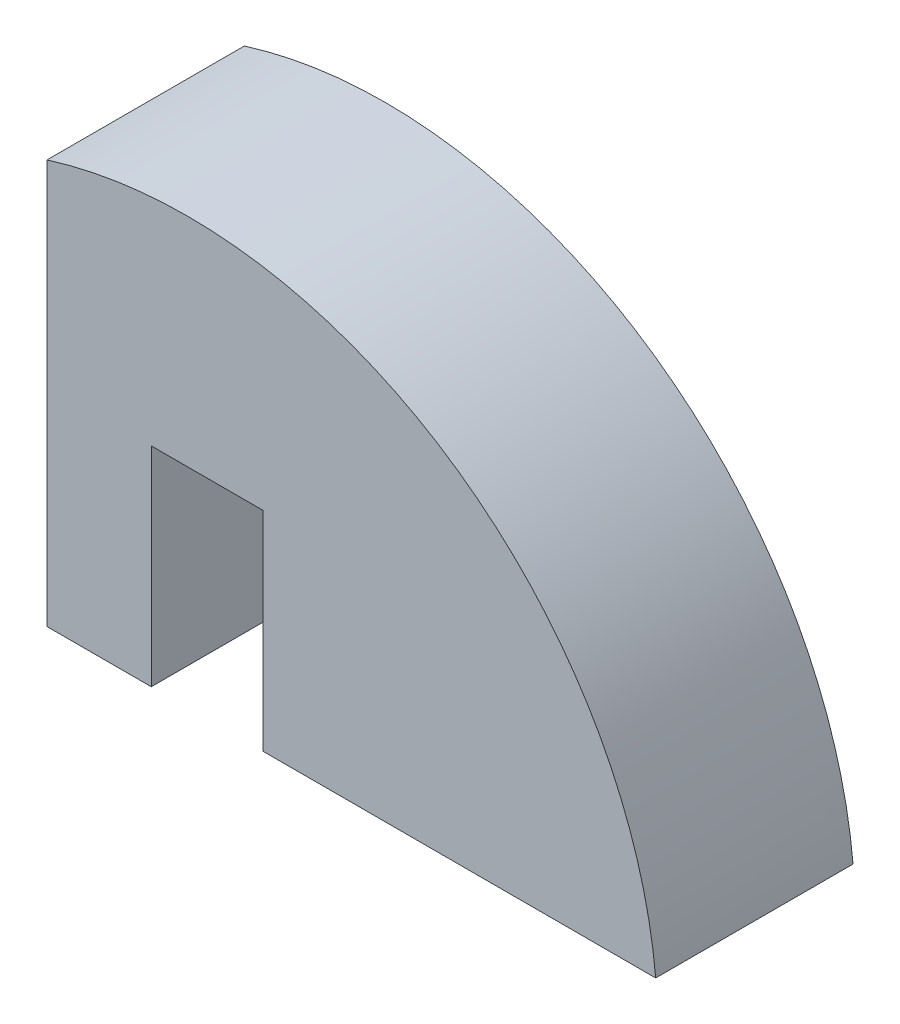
SolidWorks part; units mm, degrees
ref_plane "Plan de face" through (0, 0, 0) normal (0, 0, 1) x (1, 0, 0)
ref_plane "Plan de dessus" through (0, 0, 0) normal (0, 1, 0) x (1, 0, 0)
ref_plane "Plan de droite" through (0, 0, 0) normal (1, 0, 0) x (0, 0, -1)
sketch "Esquisse1" plane through (0, 0, 0) normal (0, 0, 1) x (1, 0, 0)
  line L0 (-150, 46.9696) -> (-150, 476.9696)
  line L1 (-150, 46.9696) -> (-39, 46.9696)
  line L2 (80, 46.9696) -> (497.789, 46.9696)
  line L4 (-39, 46.9696) -> (-39, 268.9696)
  line L5 (-39, 268.9696) -> (80, 268.9696)
  line L6 (80, 46.9696) -> (80, 268.9696)
  arc A0 (497.789, 46.9696) -> (-150, 476.9696) centre (0, 0) ccw
  dimension "D1" = 1000
  dimension "D2" = 430
  dimension "D3" = 647.789
  dimension "D4" = 111
  dimension "D5" = 119
  dimension "D6" = 222
extrude "Extrusion1" add sketch "Esquisse1" along normal blind 210
sketch "Esquisse2" plane through (0, 0, 0) normal (0, 0, -1) x (-1, 0, 0)
  line L0 (140, 469.5743) -> (140, 56.9696)
  line L1 (140, 56.9696) -> (49, 56.9696)
  line L2 (49, 56.9696) -> (49, 278.9696)
  line L3 (49, 278.9696) -> (-90, 278.9696)
  line L4 (-90, 278.9696) -> (-90, 56.9696)
  line L5 (-90, 56.9696) -> (-486.677, 56.9696)
  line L6 (150, 476.9696) -> (150, 46.9696) construction
  line L7 (150, 46.9696) -> (39, 46.9696) construction
  line L8 (39, 46.9696) -> (39, 268.9696) construction
  line L9 (39, 268.9696) -> (-80, 268.9696) construction
  line L10 (-80, 268.9696) -> (-80, 46.9696) construction
  line L11 (-80, 46.9696) -> (-497.789, 46.9696) construction
  arc A0 (140, 469.5743) -> (-486.677, 56.9696) centre (0, 0) ccw
  dimension "D1" = 980
  dimension "D2" = 10
  dimension "D3" = 10
  dimension "D4" = 10
  dimension "D5" = 10
  dimension "D6" = 10
  dimension "D7" = 10
extrude "Enlèv. mat.-Extru.1" cut sketch "Esquisse2" against normal blind 20
sketch "Esquisse4" plane through (0, 0, 0) normal (0, 0, -1) x (-1, 0, 0)
  line L0 (-80, 46.9696) -> (-497.789, 46.9696) construction
  line L1 (-486.677, 56.9696) -> (-90, 56.9696)
  line L2 (-486.677, 56.9696) -> (-486.677, 46.9696)
  line L3 (-486.677, 46.9696) -> (-90, 46.9696)
  line L4 (-90, 56.9696) -> (-90, 46.9696)
  line L5 (-80, 268.9696) -> (-80, 46.9696) construction
  line L6 (150, 476.9696) -> (150, 46.9696) construction
  line L7 (140, 469.5743) -> (150, 469.5743)
  line L8 (140, 469.5743) -> (140, 56.9696)
  line L9 (140, 56.9696) -> (150, 56.9696)
  line L10 (150, 469.5743) -> (150, 56.9696)
  line L11 (150, 46.9696) -> (39, 46.9696) construction
  dimension "D1" = 10
  dimension "D2" = 10
extrude "Enlèv. mat.-Extru.2" cut sketch "Esquisse4" against normal blind 20
sketch "Esquisse5" plane through (0, 46.9696, 0) normal (0, -1, 0) x (1, 0, 0)
  line L0 (80, 210) -> (497.789, 210) construction
  line L1 (109.12, 159.29) -> (244.49, 159.29)
  line L2 (109.12, 159.29) -> (109.12, 114.29)
  line L3 (109.12, 63.77) -> (244.49, 63.77)
  line L4 (244.49, 159.29) -> (244.49, 114.29)
  line L5 (80, 210) -> (80, 0) construction
  line L6 (109.12, 114.29) -> (244.49, 114.29)
  line L7 (244.49, 108.77) -> (109.12, 108.77)
  line L8 (244.49, 108.77) -> (244.49, 63.77)
  line L9 (109.12, 108.77) -> (109.12, 63.77)
  dimension "D1" = 95.52
  dimension "D2" = 50.71
  dimension "D3" = 135.37
  dimension "D4" = 29.12
  dimension "D5" = 45
  dimension "D6" = 45
extrude "Extrusion2" add sketch "Esquisse5" along normal blind 10
sketch "Esquisse6" plane through (0, 36.9696, 0) normal (0, -1, 0) x (1, 0, 0)
  line L0 (109.12, 159.29) -> (109.12, 114.29) construction
  line L1 (109.12, 114.29) -> (244.49, 114.29) construction
  line L2 (109.12, 114.29) -> (244.49, 114.29) construction
  line L3 (109.12, 108.77) -> (109.12, 63.77) construction
  line L4 (109.12, 63.77) -> (244.49, 63.77) construction
  circle A0 centre (131.14, 136.31) radius 19.5
  circle A1 centre (176.14, 136.31) radius 19.5
  circle A2 centre (221.14, 136.31) radius 19.5
  circle A3 centre (131.14, 85.79) radius 19.5
  circle A4 centre (176.14, 85.79) radius 19.5
  circle A5 centre (221.14, 85.79) radius 19.5
  dimension "D1" = 39
  dimension "D2" = 39
  dimension "D3" = 39
  dimension "D4" = 45
  dimension "D5" = 45
  dimension "D6" = 22.02
  dimension "D7" = 22.02
  dimension "D8" = 22.02
  dimension "D9" = 22.02
  dimension "D10" = 39
  dimension "D11" = 39
  dimension "D12" = 39
  dimension "D13" = 45
  dimension "D14" = 45
  dimension "D15" = 22.02
  dimension "D16" = 22.02
  dimension "D17" = 22.02
  dimension "D18" = 22.02
extrude "Enlèv. mat.-Extru.3" cut sketch "Esquisse6" against normal blind 10
sketch "Esquisse7" plane through (0, 46.9696, 0) normal (0, -1, 0) x (1, 0, 0)
  line L0 (111.64, 85.79) -> (240.64, 85.79) construction
  line L1 (111.64, 136.31) -> (240.64, 136.31) construction
  circle A1 centre (141.14, 85.79) radius 2.5
  circle A2 centre (166.14, 85.79) radius 2.5
  circle A3 centre (186.14, 85.79) radius 2.5
  circle A4 centre (211.14, 85.79) radius 2.5
  circle A5 centre (231.14, 85.79) radius 2.5
  circle A6 centre (121.141, 136.4505) radius 2.5
  circle A7 centre (141.141, 136.4505) radius 2.5
  circle A8 centre (166.14, 136.31) radius 2.5
  circle A9 centre (186.14, 136.31) radius 2.5
  circle A10 centre (211.14, 136.31) radius 2.5
  circle A11 centre (231.14, 136.31) radius 2.5
  circle A12 centre (131.14, 136.31) radius 19.5 construction
  circle A13 centre (176.14, 136.31) radius 19.5 construction
  circle A14 centre (221.14, 136.31) radius 19.5 construction
  circle A15 centre (221.14, 85.79) radius 19.5 construction
  circle A16 centre (176.14, 85.79) radius 19.5 construction
  circle A19 centre (121.141, 85.79) radius 2.5
  circle A20 centre (131.14, 85.79) radius 19.5 construction
  circle A21 centre (131.14, 85.79) radius 19.5 construction
  circle A22 centre (131.14, 136.31) radius 19.5 construction
  circle A23 centre (221.14, 136.31) radius 19.5 construction
  dimension "D1" = 5
  dimension "D2" = 5
  dimension "D3" = 5
  dimension "D4" = 5
  dimension "D5" = 5
  dimension "D6" = 5
  dimension "D7" = 5
  dimension "D8" = 5
  dimension "D9" = 5
  dimension "D10" = 5
  dimension "D11" = 5
  dimension "D12" = 5
  dimension "D13" = 9.999
  dimension "D14" = 20
  dimension "D15" = 20
  dimension "D16" = 20
  dimension "D17" = 20
  dimension "D18" = 20
  dimension "D19" = 10
  dimension "D20" = 10
  dimension "D21" = 10
  dimension "D22" = 10
  dimension "D23" = 10
extrude "Enlèv. mat.-Extru.4" cut sketch "Esquisse7" against normal blind 2
sketch "Esquisse8" plane through (0, 46.9696, 0) normal (0, -1, 0) x (1, 0, 0)
  circle A0 centre (131.14, 146.4505) radius 2.5
  circle A1 centre (176.2968, 146.31) radius 2.5
  circle A2 centre (221.14, 146.31) radius 2.5
  circle A3 centre (221.14, 95.79) radius 2.5
  circle A4 centre (176.2968, 95.79) radius 2.5
  circle A5 centre (131.14, 95.79) radius 2.5
  circle A6 centre (141.14, 85.79) radius 2.5 construction
  circle A7 centre (166.14, 85.79) radius 2.5 construction
  circle A11 centre (211.14, 136.31) radius 2.5 construction
  circle A12 centre (166.14, 136.31) radius 2.5 construction
  circle A13 centre (121.141, 136.4505) radius 2.5 construction
  circle A14 centre (211.14, 85.79) radius 2.5 construction
  dimension "D1" = 5
  dimension "D2" = 5
  dimension "D3" = 5
  dimension "D4" = 5
  dimension "D5" = 5
  dimension "D6" = 5
  dimension "D7" = 10
  dimension "D8" = 10
  dimension "D9" = 10
  dimension "D10" = 10
  dimension "D11" = 10
  dimension "D12" = 10
extrude "Extrusion3" add sketch "Esquisse8" along normal blind 10
fillet "Congé1" radius 1 6 edges at (221.14, 36.9696, 93.29) (176.2968, 36.9696, 93.29) (131.14, 36.9696, 93.29) (131.14, 36.9696, 143.9505) (176.2968, 36.9696, 143.81) (221.14, 36.9696, 143.81)
sketch "Esquisse9" plane through (0, 0, 20) normal (0, 0, -1) x (-1, 0, 0)
  line L0 (150, 56.9696) -> (150, 469.5743) construction
  line L1 (-80, 268.9696) -> (40, 268.9696)
  line L2 (-80, 268.9696) -> (-80, 446.6431)
  line L3 (-80, 446.6431) -> (40, 446.6431)
  line L4 (40, 268.9696) -> (40, 446.6431)
  dimension "D1" = 110
  dimension "D2" = 177.6735
extrude "Enlèv. mat.-Extru.5" cut sketch "Esquisse9" against normal blind 160
sketch "Esquisse10" plane through (0, 0, 0) normal (0, 0, -1) x (-1, 0, 0)
  line L1 (-80, 278.9696) -> (39, 278.9696)
  line L2 (-80, 278.9696) -> (-80, 268.9696)
  line L3 (-80, 268.9696) -> (39, 268.9696)
  line L4 (39, 278.9696) -> (39, 268.9696)
extrude "Enlèv. mat.-Extru.6" cut sketch "Esquisse10" against normal blind 160
sketch "Esquisse11" plane through (0, 46.9696, 0) normal (0, -1, 0) x (1, 0, 0)
  line L0 (-150, 210) -> (-39, 210) construction
  line L1 (-150, 210) -> (-150, 0) construction
  circle A0 centre (-95, 195) radius 7.5
  dimension "D1" = 15
  dimension "D2" = 15
  dimension "D3" = 55
ref_plane "Plan1" through (0, 0, 195) normal (0, 0, -1) x (-1, 0, 0)
sketch "Esquisse12" plane through (0, 0, 195) normal (0, 0, -1) x (-1, 0, 0)
  line L0 (95, 46.9696) -> (95, 7.9314) construction
  line L1 (87.5, 46.9696) -> (102.5, 46.9696) construction
  line L2 (102.5, 46.9696) -> (101.5, 38.9696)
  line L3 (101.5, 38.9696) -> (95, 38.9696)
  line L4 (102.5, 46.9696) -> (95, 46.9696)
  line L5 (95, 46.9696) -> (102.5, 46.9696)
  dimension "D1" = 8
  dimension "D2" = 1
revolve "Révolution1" add sketch "Esquisse12" angle 360 about L0
sketch "Esquisse13" plane through (0, 46.9696, 0) normal (0, -1, 0) x (1, 0, 0)
  line L0 (-150, 210) -> (-150, 0) construction
  circle A0 centre (-95, 150) radius 27.5
  dimension "D1" = 55
  dimension "D3" = 55
  dimension "D2" = 45
extrude "Extrusion4" add sketch "Esquisse13" along normal blind 4
chamfer "Chanfrein1" distance 1 angle 45 1 edges at (-95, 42.9696, 122.5)
sketch "Esquisse14" plane through (0, 42.9696, 0) normal (0, -1, 0) x (1, 0, 0)
  circle A0 centre (-95, 150) radius 6
  circle A1 centre (-82.0017, 150.211) radius 6
  circle A2 centre (-107.9983, 149.79) radius 6
  circle A3 centre (-101.3173, 138.6382) radius 6
  circle A4 centre (-88.3173, 138.8491) radius 6
  circle A5 centre (-101.681, 161.1519) radius 6
  circle A6 centre (-88.6827, 161.3629) radius 6
  dimension "D1" = 12
  dimension "D2" = 12
  dimension "D4" = 12
  dimension "D3" = 13
  dimension "D5" = 13
  dimension "D6" = 12
  dimension "D7" = 13
  dimension "D8" = 13
  dimension "D10" = 13
  dimension "D9" = 12
  dimension "D12" = 12
  dimension "D15" = 12
  dimension "D11" = 13
  dimension "D13" = 13
  dimension "D14" = 13
  dimension "D16" = 13.0009
  dimension "D17" = 13
  dimension "D18" = 13
  dimension "D19" = 12.9992
extrude "Extrusion12" add sketch "Esquisse14" along normal blind 4
fillet "Congé3" radius 0.5 7 edges at (-82.0017, 38.9696, 144.211) (-88.3173, 38.9696, 132.8491) (-101.3173, 38.9696, 132.6382) (-107.9983, 38.9696, 143.79) (-95, 38.9696, 144) (-101.681, 38.9696, 155.1519) (-88.6827, 38.9696, 155.3629)
sketch "Esquisse15" plane through (0, 38.9696, 0) normal (0, -1, 0) x (1, 0, 0)
  circle A0 centre (-101.681, 161.1519) radius 3
  circle A1 centre (-88.6827, 161.3629) radius 3
  circle A2 centre (-82.0017, 150.211) radius 3
  circle A3 centre (-88.3173, 138.8491) radius 3
  circle A4 centre (-101.3173, 138.6382) radius 3
  circle A5 centre (-107.9983, 149.79) radius 3
  circle A6 centre (-95, 150) radius 3
  dimension "D1" = 6
  dimension "D2" = 6
  dimension "D3" = 6
  dimension "D4" = 6
  dimension "D5" = 6
  dimension "D6" = 6
  dimension "D7" = 6
extrude "Enlèv. mat.-Extru.7" cut sketch "Esquisse15" against normal blind 80
sketch "Esquisse16" plane through (0, 36.9696, 0) normal (0, -1, 0) x (1, 0, 0)
  line L0 (244.49, 108.77) -> (109.12, 108.77) construction
  line L1 (199.49, 108.77) -> (198.99, 108.77)
  line L2 (199.49, 108.77) -> (199.49, 63.77)
  line L3 (199.49, 63.77) -> (198.99, 63.77)
  line L4 (198.99, 108.77) -> (198.99, 63.77)
  line L5 (109.12, 63.77) -> (244.49, 63.77) construction
  line L6 (244.49, 63.77) -> (244.49, 108.77) construction
  dimension "D1" = 45
  dimension "D2" = 0.5
extrude "Enlèv. mat.-Extru.8" cut sketch "Esquisse16" against normal blind 10
sketch "Esquisse17" plane through (0, 46.9696, 0) normal (0, -1, 0) x (1, 0, 0)
  line L0 (-150, 0) -> (-39, 0) construction
  line L1 (-99.9075, 88.5) -> (-104.815, 80)
  line L2 (-104.815, 80) -> (-99.9075, 71.5)
  line L3 (-99.9075, 71.5) -> (-90.0925, 71.5)
  line L4 (-90.0925, 71.5) -> (-85.185, 80)
  line L5 (-85.185, 80) -> (-90.0925, 88.5)
  line L6 (-90.0925, 88.5) -> (-99.9075, 88.5)
  line L7 (-100.0811, 63.5) -> (-104.9886, 55)
  line L8 (-104.9886, 55) -> (-100.0811, 46.5)
  line L9 (-100.0811, 46.5) -> (-90.2661, 46.5)
  line L10 (-90.2661, 46.5) -> (-85.3586, 55)
  line L11 (-85.3586, 55) -> (-90.2661, 63.5)
  line L12 (-90.2661, 63.5) -> (-100.0811, 63.5)
  line L13 (-39, 210) -> (-39, 0) construction
  circle A0 centre (-95, 80) radius 8.5 construction
  circle A1 centre (-95.1736, 55) radius 8.5 construction
  dimension "D1" = 17
  dimension "D2" = 17
  dimension "D3" = 25
  dimension "D4" = 55
  dimension "D5" = 46.185
  dimension "D6" = 46.3586
extrude "Extrusion13" add sketch "Esquisse17" along normal blind 4
sketch "Esquisse18" plane through (0, 42.9696, 0) normal (0, -1, 0) x (1, 0, 0)
  line L2 (-90.0925, 88.5) -> (-99.9075, 88.5) construction
  line L3 (-90.2661, 63.5) -> (-100.0811, 63.5) construction
  line L5 (-39, 210) -> (-39, 0) construction
  circle A0 centre (-95, 80) radius 5
  circle A1 centre (-95, 55) radius 5
  dimension "D1" = 10
  dimension "D2" = 10
  dimension "D3" = 8.5
  dimension "D4" = 8.5
  dimension "D5" = 25
  dimension "D6" = 56
extrude "Extrusion14" add sketch "Esquisse18" along normal blind 6
sketch "Esquisse19" plane through (0, 36.9696, 0) normal (0, -1, 0) x (1, 0, 0)
  circle A0 centre (-95, 80) radius 3
  circle A1 centre (-95, 55) radius 3
  dimension "D1" = 6
  dimension "D2" = 6
extrude "Enlèv. mat.-Extru.9" cut sketch "Esquisse19" against normal blind 80
fillet "Congé4" radius 0.5 2 edges at (-95, 36.9696, 50) (-95, 36.9696, 75)
ref_plane "Plan2" through (0, 0, 25) normal (0, 0, -1) x (-1, 0, 0)
sketch "Esquisse20" plane through (0, 0, 25) normal (0, 0, -1) x (-1, 0, 0)
  line L0 (95, 46.9696) -> (87.6827, 46.9696)
  line L1 (87.5, 46.9696) -> (102.5, 46.9696) construction
  line L2 (150, 46.9696) -> (39, 46.9696) construction
  line L3 (87.6827, 46.9696) -> (88.6827, 38.9696)
  line L4 (83.1827, 38.9696) -> (94.1827, 38.9696) construction
  line L5 (88.6827, 38.9696) -> (95, 38.9696)
  line L6 (88.5, 38.9696) -> (101.5, 38.9696) construction
  line L7 (95, 46.9696) -> (95, 38.9696)
  line L8 (95, 52.5039) -> (95, 28.7683) construction
  dimension "D1" = 1
revolve "Révolution2" add sketch "Esquisse20" angle 360 about L8
sketch "Esquisse21" plane through (0, 46.9696, 0) normal (0, -1, 0) x (1, 0, 0)
  line L0 (-140, 20) -> (486.677, 20) construction
  line L1 (177.9904, 47.5) -> (169.3301, 47.5)
  line L2 (169.3301, 47.5) -> (165, 40)
  line L3 (165, 40) -> (169.3301, 32.5)
  line L4 (169.3301, 32.5) -> (177.9904, 32.5)
  line L5 (177.9904, 32.5) -> (182.3205, 40)
  line L6 (182.3205, 40) -> (177.9904, 47.5)
  line L7 (197.8868, 50) -> (192.1132, 40)
  line L8 (192.1132, 40) -> (197.8868, 30)
  line L9 (197.8868, 30) -> (209.4338, 30)
  line L10 (209.4338, 30) -> (215.2073, 40)
  line L11 (215.2073, 40) -> (209.4338, 50)
  line L12 (209.4338, 50) -> (197.8868, 50)
  line L13 (80, 210) -> (80, 0) construction
  circle A0 centre (173.6603, 40) radius 7.5 construction
  circle A1 centre (203.6603, 40) radius 10 construction
  dimension "D1" = 20
  dimension "D2" = 15
  dimension "D3" = 30
  dimension "D4" = 20
  dimension "D5" = 20
  dimension "D6" = 85
extrude "Extrusion15" add sketch "Esquisse21" along normal blind 4
sketch "Esquisse22" plane through (0, 42.9696, 0) normal (0, -1, 0) x (1, 0, 0)
  line L0 (209.4338, 50) -> (197.8868, 50) construction
  line L1 (177.9904, 47.5) -> (169.3301, 47.5) construction
  line L2 (80, 210) -> (80, 0) construction
  circle A0 centre (173.6603, 40) radius 5
  circle A1 centre (203.6603, 40) radius 7.5
  dimension "D2" = 7.5
  dimension "D3" = 10
  dimension "D4" = 15
  dimension "D5" = 93.6603
  dimension "D6" = 30
  dimension "D1" = 10
extrude "Extrusion16" add sketch "Esquisse22" along normal blind 2
sketch "Esquisse23" plane through (0, 40.9696, 0) normal (0, -1, 0) x (1, 0, 0)
  line L1 (173.6603, 49.2376) -> (165.6603, 44.6188)
  line L2 (165.6603, 44.6188) -> (165.6603, 35.3812)
  line L3 (165.6603, 35.3812) -> (173.6603, 30.7624)
  line L4 (173.6603, 30.7624) -> (181.6603, 35.3812)
  line L5 (181.6603, 35.3812) -> (181.6603, 44.6188)
  line L6 (181.6603, 44.6188) -> (173.6603, 49.2376)
  circle A0 centre (173.6603, 40) radius 8 construction
  circle A1 centre (203.6603, 40) radius 7.5 construction
  dimension "D1" = 22
  dimension "D2" = 16
extrude "Extrusion17" add sketch "Esquisse23" along normal blind 10
sketch "Esquisse24" plane through (0, 40.9696, 0) normal (0, -1, 0) x (1, 0, 0)
  line L1 (203.6603, 52.7017) -> (192.6603, 46.3509)
  line L2 (192.6603, 46.3509) -> (192.6603, 33.6491)
  line L3 (192.6603, 33.6491) -> (203.6603, 27.2983)
  line L4 (203.6603, 27.2983) -> (214.6603, 33.6491)
  line L5 (214.6603, 33.6491) -> (214.6603, 46.3509)
  line L6 (214.6603, 46.3509) -> (203.6603, 52.7017)
  line L8 (-140, 20) -> (486.677, 20) construction
  circle A0 centre (203.6603, 40) radius 11 construction
  dimension "D1" = 22
  dimension "D2" = 7.2983
extrude "Extrusion18" add sketch "Esquisse24" along normal blind 15
sketch "Esquisse25" plane through (0, 30.9696, 0) normal (0, -1, 0) x (1, 0, 0)
  line L0 (-140, 20) -> (486.677, 20) construction
  line L2 (80, 180) -> (80, 20) construction
  circle A1 centre (173.6603, 40) radius 8
  dimension "D1" = 20
  dimension "D4" = 16
  dimension "D6" = 93.6603
extrude "Extrusion19" add sketch "Esquisse25" along normal blind 3
fillet "Congé5" radius 2.5 1 edges at (173.6603, 27.9696, 32)
sketch "Esquisse26" plane through (0, 25.9696, 0) normal (0, -1, 0) x (1, 0, 0)
  line L0 (486.677, 20) -> (90, 20) construction
  line L1 (80, 210) -> (80, 0) construction
  circle A0 centre (203.6603, 40) radius 11.0407
  dimension "D1" = 20
  dimension "D2" = 22.0815
  dimension "D3" = 123.6603
extrude "Extrusion20" add sketch "Esquisse26" along normal blind 5
fillet "Congé6" radius 2.5 1 edges at (203.6603, 20.9696, 28.9593)
sketch "Esquisse27" plane through (0, 27.9696, 0) normal (0, -1, 0) x (1, 0, 0)
  circle A0 centre (173.6603, 40) radius 3.5
  dimension "D1" = 7
extrude "Enlèv. mat.-Extru.11" cut sketch "Esquisse27" against normal blind 80
sketch "Esquisse28" plane through (0, 20.9696, 0) normal (0, -1, 0) x (1, 0, 0)
  circle A0 centre (203.6603, 40) radius 6
  dimension "D1" = 12
extrude "Enlèv. mat.-Extru.12" cut sketch "Esquisse28" against normal blind 80
